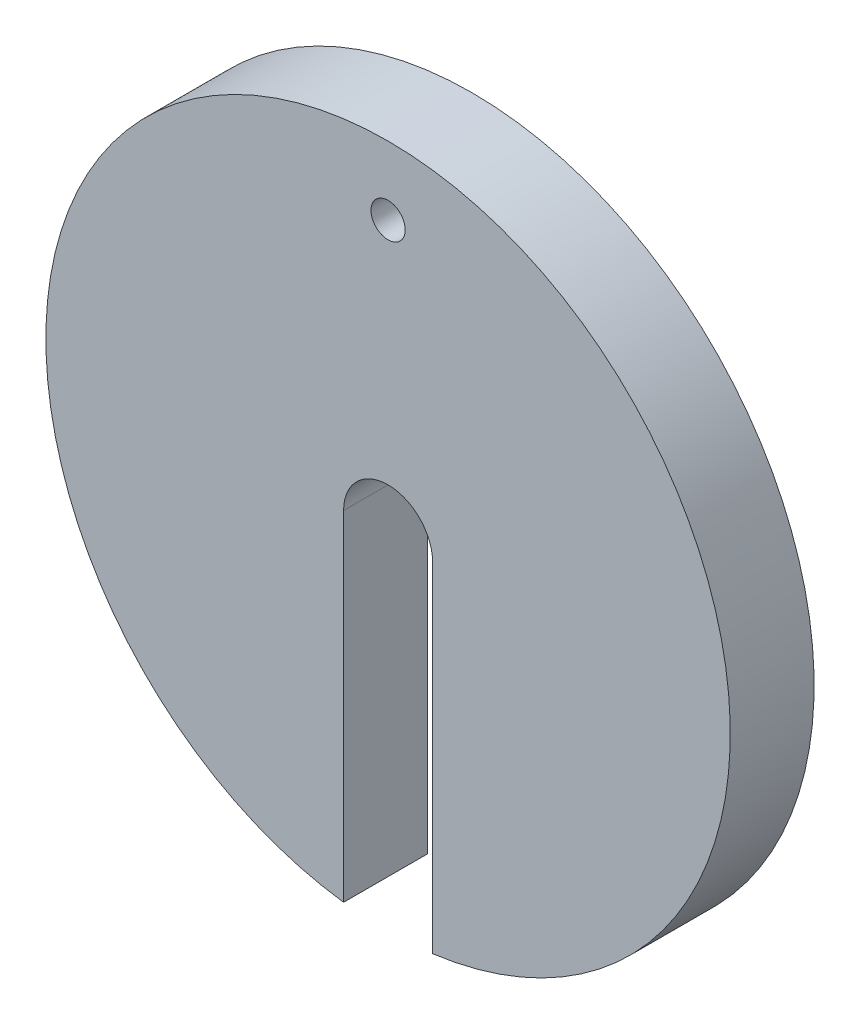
SolidWorks part; units mm, degrees
ref_plane "Face" through (0, 0, 0) normal (0, 0, 1) x (1, 0, 0)
ref_plane "Dessus" through (0, 0, 0) normal (0, 1, 0) x (1, 0, 0)
ref_plane "Droite" through (0, 0, 0) normal (1, 0, 0) x (0, 0, -1)
sketch "Esquisse1" plane through (0, 0, 0) normal (0, 0, 1) x (1, 0, 0)
  line L0 (-6.5, 0) -> (-6.5, -49.5757)
  line L1 (6.5, 0) -> (6.5, -49.5757)
  line L2 (0, 0) -> (0, 45.082) construction
  arc A0 (6.5, -49.5757) -> (-6.5, -49.5757) centre (0, 0) ccw
  arc A1 (6.5, 0) -> (-6.5, 0) centre (0, 0) ccw
  circle A2 centre (0, 40) radius 2.5
  dimension "D1" = 13
  dimension "D2" = 100
  dimension "D3" = 5
  dimension "D4" = 40
extrude "Base-Extrusion" add sketch "Esquisse1" along normal blind 12.25
sketch "Esq_WRNL_Compact001" plane through (0, 0, 0) normal (0, 0, 1) x (1, 0, 0)
  line L0 (-51, -50.5757) -> (-51, 51)
  line L1 (51, -50.5757) -> (51, 51)
  line L2 (-51, -50.5757) -> (51, -50.5757)
  line L3 (-51, 51) -> (51, 51)
